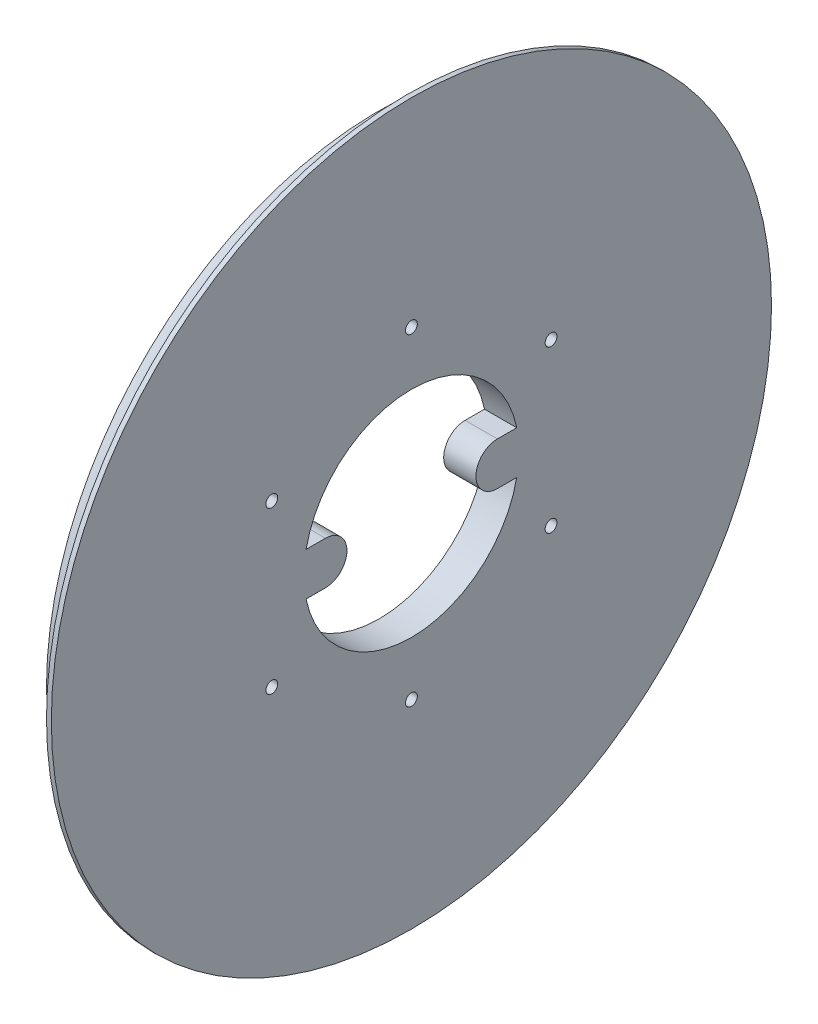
SolidWorks part; units mm, degrees
ref_plane "Plane1" through (0, 0, 0) normal (0, 0, 1) x (1, 0, 0)
ref_plane "Plane2" through (0, 0, 0) normal (0, 1, 0) x (1, 0, 0)
ref_plane "Plane3" through (0, 0, 0) normal (1, 0, 0) x (0, 0, -1)
sketch "Esquisse3" plane through (0, 0, 0) normal (0, 0, 1) x (1, 0, 0)
  line L0 (0, -12.3895) -> (0, 140.6228) construction
  line L1 (-19.0782, 0) -> (165.3613, 0) construction
  line L2 (6, 91.9241) -> (6, -6.8806) construction
  line L3 (-7.6644, 61.9) -> (65.197, 61.9) construction
  line L4 (-7.6644, 67) -> (93.8579, 67) construction
  line L5 (-7.6644, 80) -> (107.7261, 80) construction
  line L7 (12, -12.3895) -> (12, 140.6228) construction
  line L8 (-7.6644, 72.1) -> (65.197, 72.1) construction
  line L9 (6, 61.9) -> (6, 0)
  line L12 (-2.5, 99.8222) -> (-2.5, 77.136) construction
  line L19 (11.1, 67) -> (12, 67)
  line L20 (12, 67) -> (12, 0)
  line L21 (12, 0) -> (6, 0)
  circle A0 centre (6, 67) radius 5 construction
  arc A1 (6, 61.9) -> (11.1, 67) centre (6, 67) ccw
  dimension "D7" = 5.1
  dimension "D4" = 67
  dimension "D2" = 80
  dimension "D5" = 12
  dimension "D6" = 5.1
  dimension "D11" = 2.5
revolve "Révolution1" add sketch "Esquisse3" angle 360 about L1
sketch "Esquisse5" plane through (6, 0, 0) normal (-1, 0, 0) x (0, 0, 1)
  line L0 (0, -35.731) -> (0, 32.7316) construction
  line L1 (-23.0499, 0) -> (37.1846, 0) construction
  line L2 (-12, 6.3315) -> (-12, -1.869) construction
  line L3 (-16, 6.3315) -> (-16, -1.869) construction
  line L4 (-25.5061, 4) -> (-7.3619, 4) construction
  line L5 (-25.5061, -4) -> (-7.3619, -4) construction
  line L6 (-19.5959, 4) -> (-16, 4)
  line L7 (-19.5959, -4) -> (-16, -4)
  line L8 (19.5959, -4) -> (16, -4)
  line L9 (19.5959, 4) -> (16, 4)
  circle A0 centre (0, 0) radius 30 construction
  arc A1 (-19.5959, -4) -> (19.5959, -4) centre (0, 0) ccw
  circle A2 centre (0, 30) radius 1.1
  circle A3 centre (25.9808, 15) radius 1.1
  circle A4 centre (25.9808, -15) radius 1.1
  circle A5 centre (0, -30) radius 1.1
  circle A6 centre (-25.9808, -15) radius 1.1
  circle A7 centre (-25.9808, 15) radius 1.1
  arc A8 (-16, -4) -> (-16, 4) centre (-16, 0) ccw
  arc A9 (16, -4) -> (16, 4) centre (16, 0) cw
  arc A10 (19.5959, 4) -> (-19.5959, 4) centre (0, 0) ccw
  dimension "D1" = 6
  dimension "D2" = 4
  dimension "D3" = 8
  dimension "D4" = 4
  dimension "D5" = 12
extrude "Enlèv. mat.-Extru.1" cut sketch "Esquisse5" against normal blind 6
